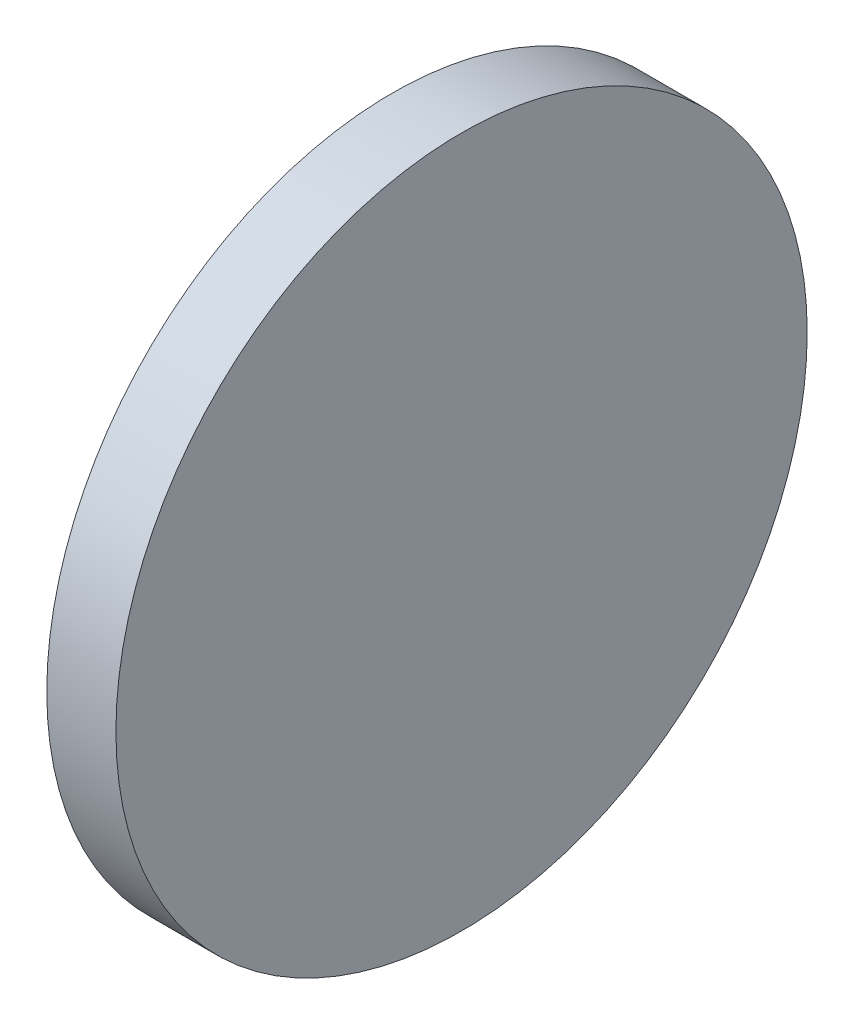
SolidWorks part; units mm, degrees
ref_plane "Front" through (0, 0, 0) normal (0, 0, 1) x (1, 0, 0)
ref_plane "Top" through (0, 0, 0) normal (0, 1, 0) x (1, 0, 0)
ref_plane "Right" through (0, 0, 0) normal (1, 0, 0) x (0, 0, -1)
sketch "Sketch1" plane through (0, 0, 0) normal (1, 0, 0) x (0, 0, -1)
  circle A0 centre (0, 0) radius 1.905
  dimension "D1" = 3.81
extrude "Extrude1" add sketch "Sketch1" along normal blind 0.381
